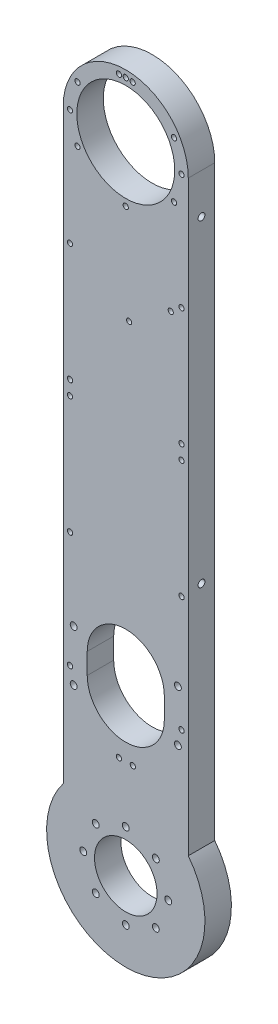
SolidWorks part; units mm, degrees
ref_plane "Front Plane" through (0, 0, 0) normal (0, 0, 1) x (1, 0, 0)
ref_plane "Top Plane" through (0, 0, 0) normal (0, 1, 0) x (1, 0, 0)
ref_plane "Right Plane" through (0, 0, 0) normal (1, 0, 0) x (0, 0, -1)
ref_plane "Plane1" through (0, 0, 12.7) normal (0, 0, 1) x (1, 0, 0)
sketch "Sketch1" plane through (0, 0, 12.7) normal (0, 0, 1) x (1, 0, 0)
  line L0 (-30, 305) -> (-30, 23.3238)
  line L1 (30, 23.3238) -> (30, 305)
  arc A0 (30, 305) -> (-30, 305) centre (0, 305) ccw
  arc A1 (-30, 23.3238) -> (30, 23.3238) centre (0, 0) ccw
extrude "Boss-Extrude1" add sketch "Sketch1" against normal blind 12.7
sketch "Sketch2" plane through (0, 0, 0) normal (0, 0, -1) x (-1, 0, 0)
  line L0 (18.5, 74.0225) -> (18.5, 84.0225)
  line L1 (-18.5, 84.0225) -> (-18.5, 74.0225)
  arc A0 (18.5, 84.0225) -> (-18.5, 84.0225) centre (0, 84.0225) ccw
  arc A1 (-18.5, 74.0225) -> (18.5, 74.0225) centre (0, 74.0225) ccw
extrude "Cut-Extrude1" cut sketch "Sketch2" against normal through all
hole_wizard "Hole1" positions "Sketch4" profile "Sketch3" legacy
sketch "Sketch4" plane through (0, 0, 12.7) normal (0, 0, 1) x (1, 0, 0)
  point P0 (0, 0)
sketch "Sketch3" plane through (0, 0, 12.7) normal (1, 0, 0) x (0, -1, 0)
  line L0 (0, 0) -> (0, 12.7)
  line L1 (0, 12.7) -> (15, 12.7)
  line L2 (15, 12.7) -> (15, 0)
  line L3 (15, 0) -> (0, 0)
  line L4 (0, 110) -> (0, -10) construction
  dimension "Diameter" = 30
  dimension "Depth" = 12.7
hole_wizard "Hole2" positions "Sketch6" profile "Sketch5" legacy
sketch "Sketch6" plane through (0, 0, 12.7) normal (0, 0, 1) x (1, 0, 0)
  point P0 (0, 305)
sketch "Sketch5" plane through (0, 305, 12.7) normal (1, 0, 0) x (0, -1, 0)
  line L0 (0, 0) -> (0, 12.7)
  line L1 (0, 12.7) -> (23.5, 12.7)
  line L2 (23.5, 12.7) -> (23.5, 0)
  line L3 (23.5, 0) -> (0, 0)
  line L4 (0, 110) -> (0, -10) construction
  dimension "Diameter" = 47
  dimension "Depth" = 12.7
hole_wizard "#39 (0.0995) Diameter Hole1" positions "Sketch8" profile "Sketch7" hole size "#39" standard "ANSI Inch"
sketch "Sketch8" plane through (0, 0, 12.7) normal (0, 0, 1) x (1, 0, 0)
  point P0 (-26.75, 74.0225)
  point P1 (-26.75, 129.5112)
  point P2 (-26.75, 186.1112)
  point P3 (-26.75, 192.9112)
  point P4 (-26.75, 249.5112)
  point P5 (-26.75, 305)
  point P6 (-3.3, 331.5457)
  point P7 (3.3, 331.5457)
  point P8 (26.75, 305)
  point P9 (26.75, 249.5112)
  point P10 (26.75, 192.9112)
  point P11 (26.75, 186.1112)
  point P12 (26.75, 129.5112)
  point P13 (26.75, 74.0225)
  point P14 (3.4, 47.4894)
  point P15 (-3.3, 47.4768)
  point P16 (-23.1662, 318.375)
  point P17 (-23.1662, 291.625)
  point P18 (0, 278.25)
  point P19 (23.1662, 291.625)
  point P20 (23.1662, 318.375)
  point P21 (0, 331.75)
sketch "Sketch7" plane through (-26.75, 74.0225, 12.7) normal (1, 0, 0) x (0, -1, 0)
  line L0 (0, 0) -> (0, 12.7)
  line L1 (0, 12.7) -> (1.2636, 12.7)
  line L2 (1.2636, 12.7) -> (1.2636, 0)
  line L5 (1.2636, 0) -> (0, 0)
  line L11 (0, -6.35) -> (0, 107.95) construction
  dimension "Thru Hole Dia." = 2.5273
  dimension "Thru Hole Depth" = 12.7
hole_wizard "#4 Clearance Hole1" positions "Sketch10" profile "Sketch9" hole size "#4" standard "ANSI Inch"
sketch "Sketch10" plane through (0, 0, 0) normal (0, 0, -1) x (-1, 0, 0)
  point P0 (25, 66.7725)
  point P1 (25, 91.2725)
  point P2 (-25, 66.7725)
  point P3 (-25, 91.2725)
  point P4 (14.425, 14.425)
  point P5 (20.4, 0)
  point P6 (14.425, -14.425)
  point P7 (0, -20.4)
  point P8 (-14.425, -14.425)
  point P9 (-20.4, 0)
  point P10 (-14.425, 14.425)
  point P11 (0, 20.4)
sketch "Sketch9" plane through (-25, 66.7725, 0) normal (1, 0, 0) x (0, 1, 0)
  line L0 (0, 0) -> (0, 12.7)
  line L1 (0, 12.7) -> (1.65, 12.7)
  line L2 (1.65, 12.7) -> (1.65, 0)
  line L5 (1.65, 0) -> (0, 0)
  line L11 (0, -6.35) -> (0, 107.95) construction
  dimension "Thru Hole Dia." = 3.3
  dimension "Thru Hole Depth" = 12.7
hole_wizard "#2 Clearance Hole1" positions "Sketch12" profile "Sketch11" hole size "#2" standard "ANSI Inch"
sketch "Sketch12" plane through (0, 0, 0) normal (0, 0, -1) x (-1, 0, 0)
  point P0 (-1.6199, 231.2653)
  point P1 (-21.5789, 245.4337)
sketch "Sketch11" plane through (1.6199, 231.2653, 0) normal (1, 0, 0) x (0, 1, 0)
  line L0 (0, 0) -> (0, 12.7)
  line L1 (0, 12.7) -> (1.25, 12.7)
  line L2 (1.25, 12.7) -> (1.25, 0)
  line L5 (1.25, 0) -> (0, 0)
  line L11 (0, -6.35) -> (0, 107.95) construction
  dimension "Thru Hole Dia." = 2.5
  dimension "Thru Hole Depth" = 12.7
hole_wizard "#4 Clearance Hole2" positions "Sketch14" profile "Sketch13" hole size "#4" standard "ANSI Inch"
sketch "Sketch14" plane through (30, 0, 0) normal (1, 0, 0) x (0, 0, -1)
  point P0 (-6.35, 285.7238)
  point P1 (-6.35, 133.3238)
sketch "Sketch13" plane through (30, 285.7238, 6.35) normal (0, 1, 0) x (0, 0, -1)
  line L0 (0, 0) -> (0, 10)
  line L1 (0, 10) -> (1.65, 10)
  line L2 (1.65, 10) -> (1.65, 0)
  line L5 (1.65, 0) -> (0, 0)
  line L10 (0, 10) -> (-1.65, 10) construction
  line L11 (0, -6.35) -> (0, 107.95) construction
  dimension "Hole Dia." = 3.3
  dimension "Hole Depth" = 10
  dimension "Drill Angle" = 180
